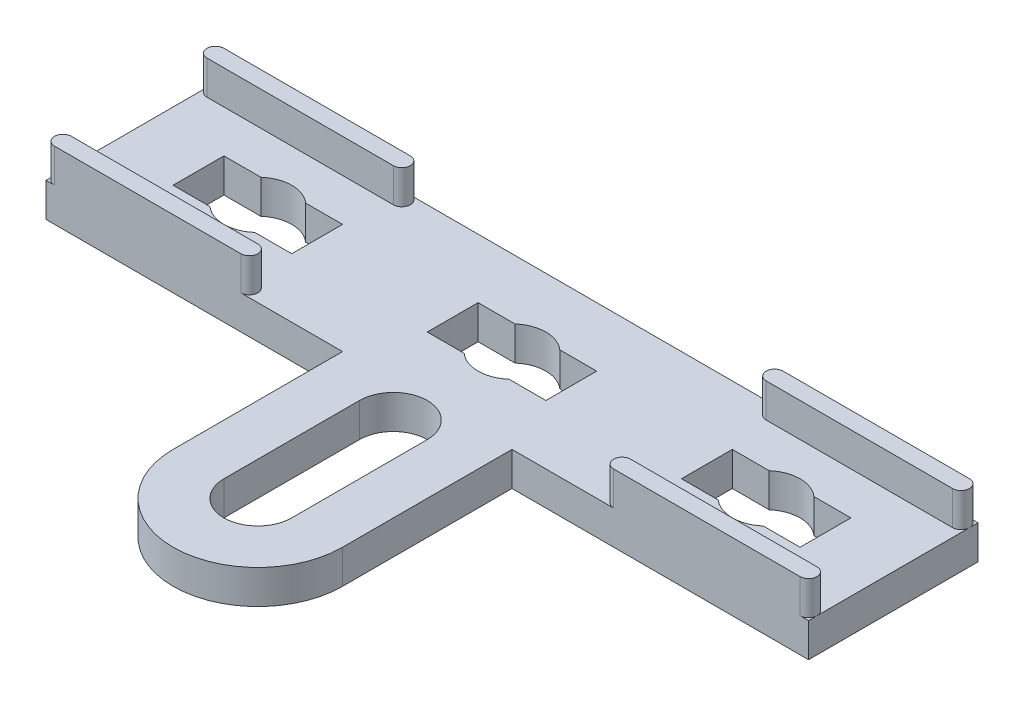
SolidWorks part; units mm, degrees
ref_plane "前视基准面" through (0, 0, 0) normal (0, 0, 1) x (1, 0, 0)
ref_plane "上视基准面" through (0, 0, 0) normal (0, 1, 0) x (1, 0, 0)
ref_plane "右视基准面" through (0, 0, 0) normal (1, 0, 0) x (0, 0, -1)
sketch "草图1" plane through (0, 0, 0) normal (0, 1, 0) x (1, 0, 0)
  line L0 (22.5, 5) -> (22.5, -5)
  line L1 (22.5, 5) -> (-22.5, 5)
  line L2 (22.5, -5) -> (5, -5)
  line L3 (-22.5, 5) -> (-22.5, -5)
  line L4 (22.5, 5) -> (-22.5, -5) construction
  line L5 (22.5, -5) -> (-22.5, 5) construction
  line L6 (0, 0) -> (-5, 0) construction
  line L7 (-5, -5) -> (-22.5, -5)
  line L8 (-5, -15) -> (5, -15) construction
  line L9 (5, -15) -> (5, -5)
  line L10 (5, 0) -> (0, 0) construction
  line L11 (-5, -5) -> (-5, -15)
  arc A0 (-5, -15) -> (5, -15) centre (0, -15) ccw
  point P1 (0, 0)
  dimension "D1" = 10
  dimension "D2" = 45
  dimension "D3" = 5
  dimension "D4" = 5
  dimension "D5" = 15
  dimension "D6" = 5
  dimension "D7" = 10
extrude "凸台-拉伸1" add sketch "草图1" along normal blind 2
sketch "草图2" plane through (0, 2, 0) normal (0, 1, 0) x (1, 0, 0)
  line L0 (-22.5, 5) -> (-22.5, 4.5) construction
  line L2 (-22.5, 5) -> (-22.5, -5) construction
  line L5 (-22, 4) -> (-11, 4)
  line L7 (-22, 5) -> (-11, 5)
  arc A0 (-22, 5) -> (-22, 4) centre (-22, 4.5) ccw
  arc A1 (-11, 4) -> (-11, 5) centre (-11, 4.5) ccw
extrude "凸台-拉伸2" add sketch "草图2" along normal blind 2
mirror "镜向1" about plane through (0, 0, 0) normal (0, 0, 1) of "凸台-拉伸2"
pattern_linear "阵列(线性)1" count 2 spacing 33 along (1, 0, 0) of "镜向1", "凸台-拉伸2"
sketch "草图4" plane through (0, 2, 0) normal (0, 1, 0) x (1, 0, 0)
  line L0 (3.5, 1.5) -> (3.5, -1.5)
  line L1 (3.5, 1.5) -> (1.3229, 1.5)
  line L2 (3.5, -1.5) -> (1.3229, -1.5)
  line L3 (-3.5, 1.5) -> (-3.5, -1.5)
  line L4 (3.5, 1.5) -> (-3.5, -1.5) construction
  line L5 (3.5, -1.5) -> (-3.5, 1.5) construction
  line L6 (-1.3229, 1.5) -> (-3.5, 1.5)
  line L7 (-1.3229, -1.5) -> (-3.5, -1.5)
  arc A0 (-1.3229, -1.5) -> (1.3229, -1.5) centre (0, 0) ccw
  arc A1 (1.3229, 1.5) -> (-1.3229, 1.5) centre (0, 0) ccw
  dimension "D1" = 4
  dimension "D2" = 3
  dimension "D3" = 7
extrude "切除-拉伸1" cut sketch "草图4" against normal up to next
pattern_linear "阵列(线性)2" count 2 spacing 15 along (1, 0, 0) count 2 spacing 15 along (-1, 0, 0) of "切除-拉伸1"
sketch "草图5" plane through (0, 2, 0) normal (0, 1, 0) x (1, 0, 0)
  line L0 (-5, -5) -> (-5, -15) construction
  line L1 (5, -15) -> (5, -5) construction
  line L2 (-5, -5) -> (-5, -15) construction
  line L3 (5, -15) -> (5, -5) construction
  line L4 (-2, -7) -> (-2, -15)
  line L5 (2, -15) -> (2, -7)
  line L6 (0, -15) -> (0, -7) construction
  line L8 (-2, -5) -> (-2, -15) construction
  line L9 (2, -15) -> (2, -5) construction
  arc A0 (-5, -15) -> (5, -15) centre (0, -15) ccw construction
  arc A1 (-5, -15) -> (5, -15) centre (0, -15) ccw construction
  arc A2 (-2, -15) -> (2, -15) centre (0, -15) ccw
  arc A3 (2, -7) -> (-2, -7) centre (0, -7) ccw
  dimension "D2" = 8
  dimension "D1" = 3
extrude "切除-拉伸2" cut sketch "草图5" against normal blind 10
